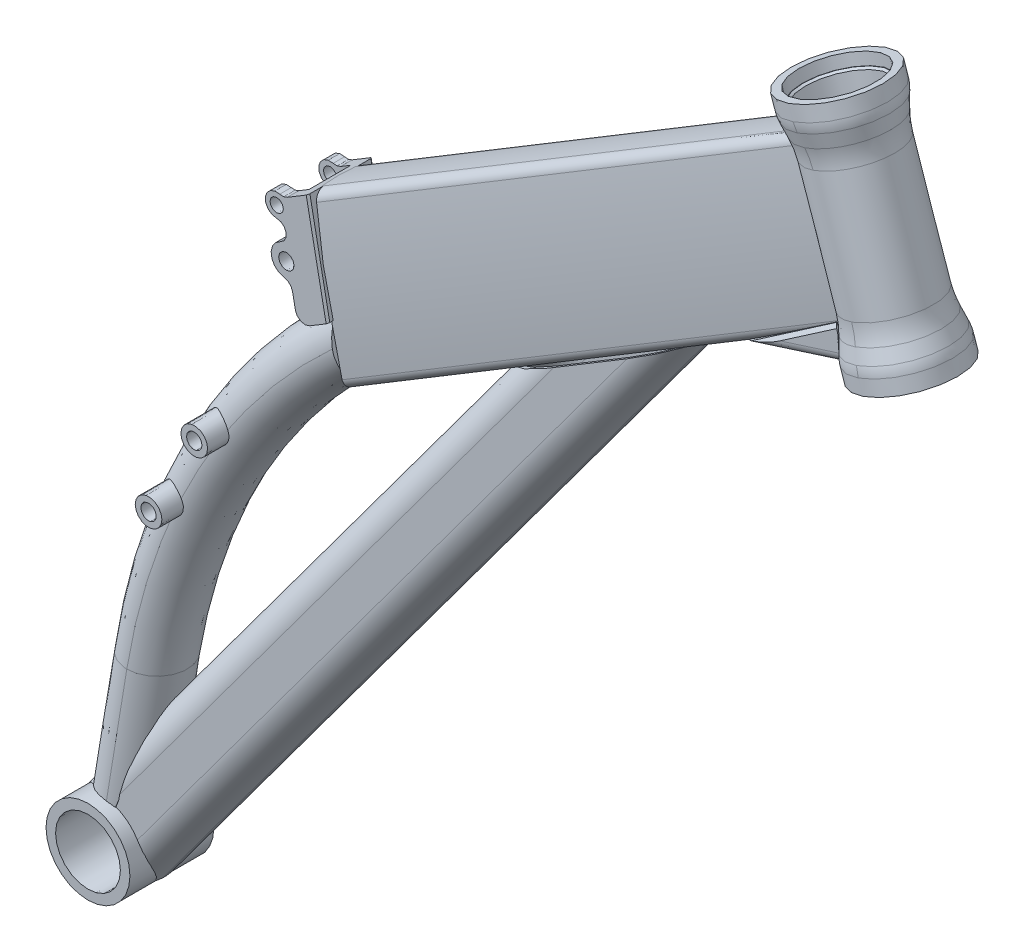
SolidWorks part; units mm, degrees
ref_plane "Face" through (0, 0, 0) normal (0, 0, 1) x (1, 0, 0)
ref_plane "Dessus" through (0, 0, 0) normal (0, 1, 0) x (1, 0, 0)
ref_plane "Droite" through (0, 0, 0) normal (1, 0, 0) x (0, 0, -1)
imported_body "Surface-Importée1"
imported_body "Importée2"
imported_body "Importée3"
imported_body "Surface-Importée2"
imported_body "Importée4"
imported_body "Surface-Importée3"
imported_body "Surface-Importée4"
imported_body "Surface-Importée5"
imported_body "Importée6"
sketch "Esquisse1" plane through (0, 0, 0) normal (1, 0, 0) x (0, 0, -1)
  line L0 (0, -14.9842) -> (0, -25.8324) construction
  line L1 (0, -22) -> (0, -17) construction
  line L2 (-6, -22) -> (-3, -19)
  line L3 (-6, -22) -> (0, -22)
  line L4 (-3, -19) -> (0, -19)
  line L5 (-22, -22) -> (-3, -22) construction
  line L6 (0, -22) -> (0, -19)
  dimension "D1" = 45
  dimension "D2" = 12
  dimension "D3" = 3
revolve "Enlèvement de matière-Révolution1" cut sketch "Esquisse1" angle 360 about L0
ref_plane "Plan1" [suppressed] through (0, 0, 50) normal (0, 0, 1) x (1, 0, 0)
sketch "Esquisse2" [suppressed] plane through (0, 0, 50) normal (0, 0, 1) x (1, 0, 0)
  line L1 (301.834, 357.4423) -> (494.5792, 357.4423)
  line L2 (494.5792, 357.4423) -> (494.5792, 578.372)
  line L3 (494.5792, 578.372) -> (232.7366, 578.372)
  line L4 (232.7366, 578.372) -> (232.7366, 464.725)
  spline_without_curve S0
sketch "Esquisse3" plane through (0, 0, 17) normal (0, 0, 1) x (1, 0, 0)
  circle A2 centre (93.92, 337.98) radius 3.5
  circle A3 centre (93.92, 337.98) radius 3.5
  dimension "D1" = 0.5
extrude "Enlèv. mat.-Extru.2" cut sketch "Esquisse3" against normal through all
